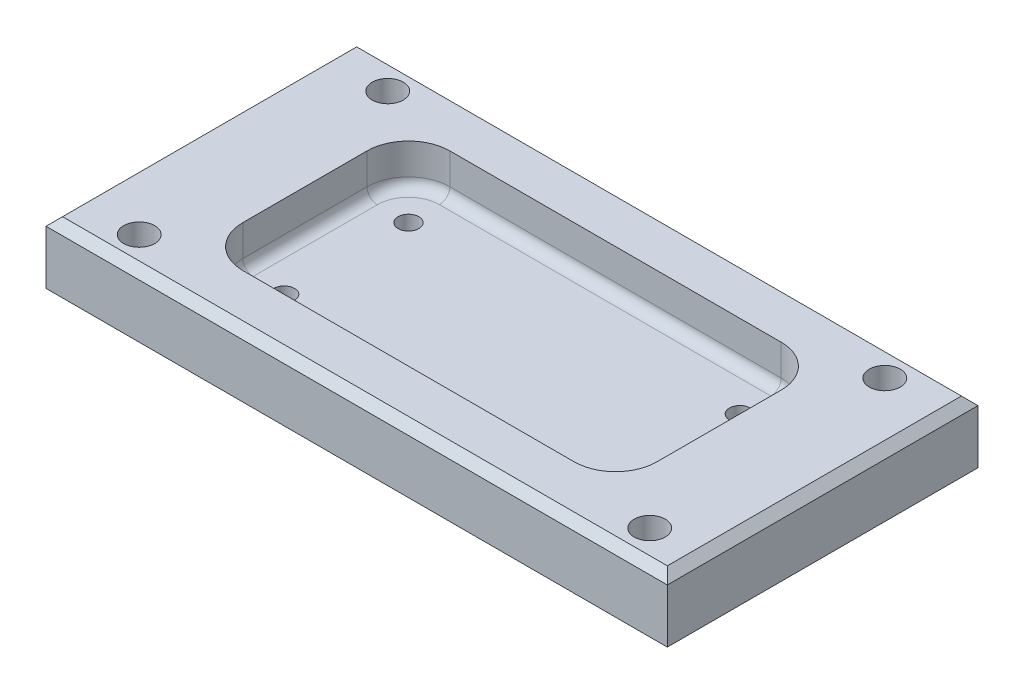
SolidWorks part; units mm, degrees
ref_plane "Front Plane" through (0, 0, 0) normal (0, 0, 1) x (1, 0, 0)
ref_plane "Top Plane" through (0, 0, 0) normal (0, 1, 0) x (1, 0, 0)
ref_plane "Right Plane" through (0, 0, 0) normal (1, 0, 0) x (0, 0, -1)
sketch "Sketch1" plane through (0, 0, 0) normal (0, 1, 0) x (1, 0, 0)
  line L1 (-75, -37.5) -> (75, -37.5)
  line L2 (-75, -37.5) -> (-75, 37.5)
  line L3 (-75, 37.5) -> (75, 37.5)
  line L4 (75, -37.5) -> (75, 37.5)
  line L5 (-75, -37.5) -> (75, 37.5) construction
  line L6 (-75, 37.5) -> (75, -37.5) construction
  point P0 (0, 0)
  dimension "D1" = 150
  dimension "D2" = 75
extrude "Base Feature" add sketch "Sketch1" along normal blind 15
sketch "Sketch2" plane through (0, 15, 0) normal (0, 1, 0) x (1, 0, 0)
  line L1 (-50, -25) -> (50, -25)
  line L2 (-50, -25) -> (-50, 25)
  line L3 (-50, 25) -> (50, 25)
  line L4 (50, -25) -> (50, 25)
  line L5 (-50, -25) -> (50, 25) construction
  line L6 (-50, 25) -> (50, -25) construction
  point P0 (0, 0)
  dimension "D1" = 100
  dimension "D2" = 50
extrude "Pocket" cut sketch "Sketch2" against normal blind 10
sketch "Sketch3" plane through (0, 15, 0) normal (0, 1, 0) x (1, 0, 0)
  line L0 (0, 0) -> (-62.7629, 0) construction
  line L1 (0, 0) -> (0, 45.536) construction
  circle A0 centre (-60, 30) radius 3.75
  circle A1 centre (-60, -30) radius 3.75
  circle A2 centre (60, 30) radius 3.75
  circle A3 centre (62.9824, -29.7356) radius 3.75
  dimension "D3" = 7.5
  dimension "D1" = 120
  dimension "D2" = 60
extrude "D6 Hole" cut sketch "Sketch3" against normal through all
fillet "Fillet R10" radius 10 4 edges at (-50, 10, 25) (50, 10, 25) (50, 10, -25) (-50, 10, -25)
sketch "Sketch4" plane through (0, 5, 0) normal (0, 1, 0) x (1, 0, 0)
  circle A0 centre (-40, 15) radius 2.5
  circle A1 centre (-40, -15) radius 2.5
  circle A2 centre (40, 15) radius 2.5
  circle A3 centre (40, -15) radius 2.5
  arc A4 (-40, 25) -> (-50, 15) centre (-40, 15) ccw construction
  arc A5 (-50, -15) -> (-40, -25) centre (-40, -15) ccw construction
  dimension "D1" = 5
extrude "D5 Hole" cut sketch "Sketch4" against normal blind 10
fillet "Fillet R2.5" radius 2.5 8 edges at (47.0711, 5, -22.0711) (50, 5, 0) (47.0711, 5, 22.0711) (0, 5, 25) (-47.0711, 5, 22.0711) (-50, 5, 0) (-47.0711, 5, -22.0711) (0, 5, -25)
chamfer "Chamfer" distance 2 angle 45 4 edges at (75, 15, 0) (0, 15, -37.5) (-75, 15, 0) (0, 15, 37.5)
